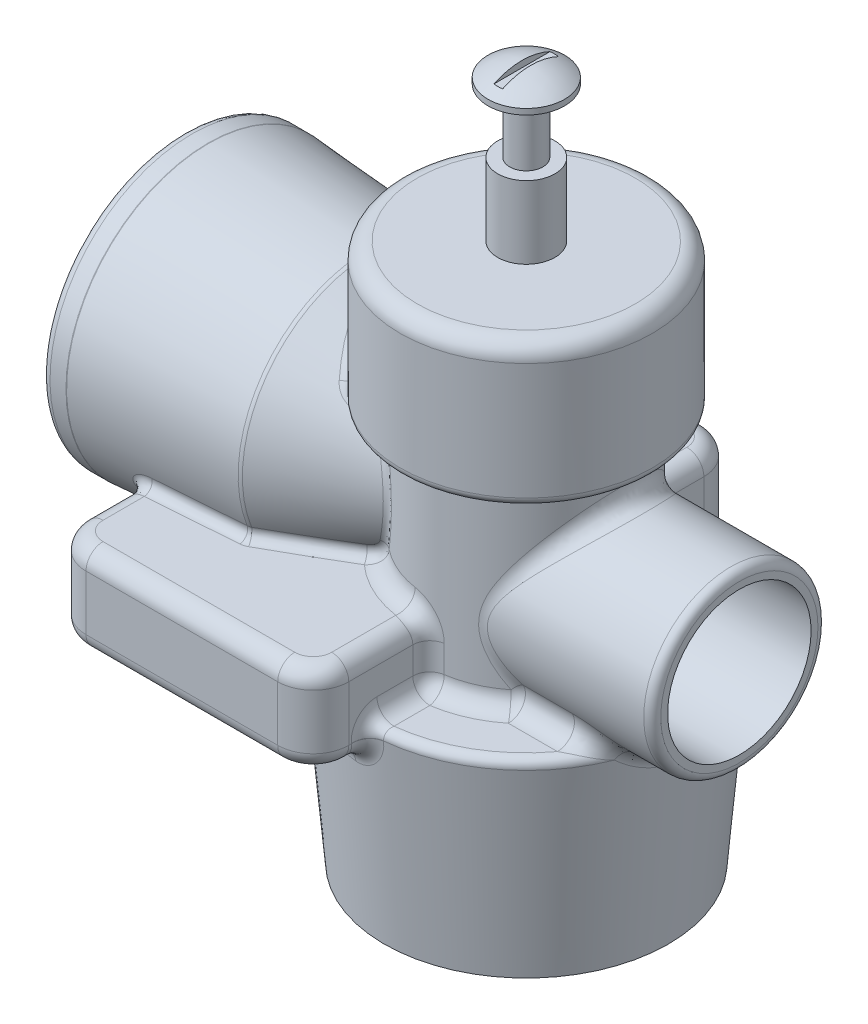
SolidWorks part; units mm, degrees
ref_plane "Plane1" through (0, 0, 0) normal (0, 0, 1) x (1, 0, 0)
ref_plane "Plane2" through (0, 0, 0) normal (0, 1, 0) x (1, 0, 0)
ref_plane "Plane3" through (0, 0, 0) normal (1, 0, 0) x (0, 0, -1)
imported_body "Imported1"
other "Cavity1"
other "Knob, Gas Valve<1>@Propane Valve Assembly"
sketch "Sketch1" plane through (0, 0, 0) normal (0, -1, 0) x (1, 0, 0)
  circle A0 centre (0, 0) radius 10.2391
extrude "Cut-Extrude1" cut sketch "Sketch1" against normal blind 16.51
sketch "Sketch4" plane through (19.05, 0, 0) normal (1, 0, 0) x (0, 0, -1)
  circle A0 centre (0, 24.2377) radius 6.0502 construction
  circle A1 centre (0, 24.2377) radius 6.4152
  point P0 (0, 24.2377)
extrude "Cut-Extrude4" cut sketch "Sketch4" against normal blind 20.32
